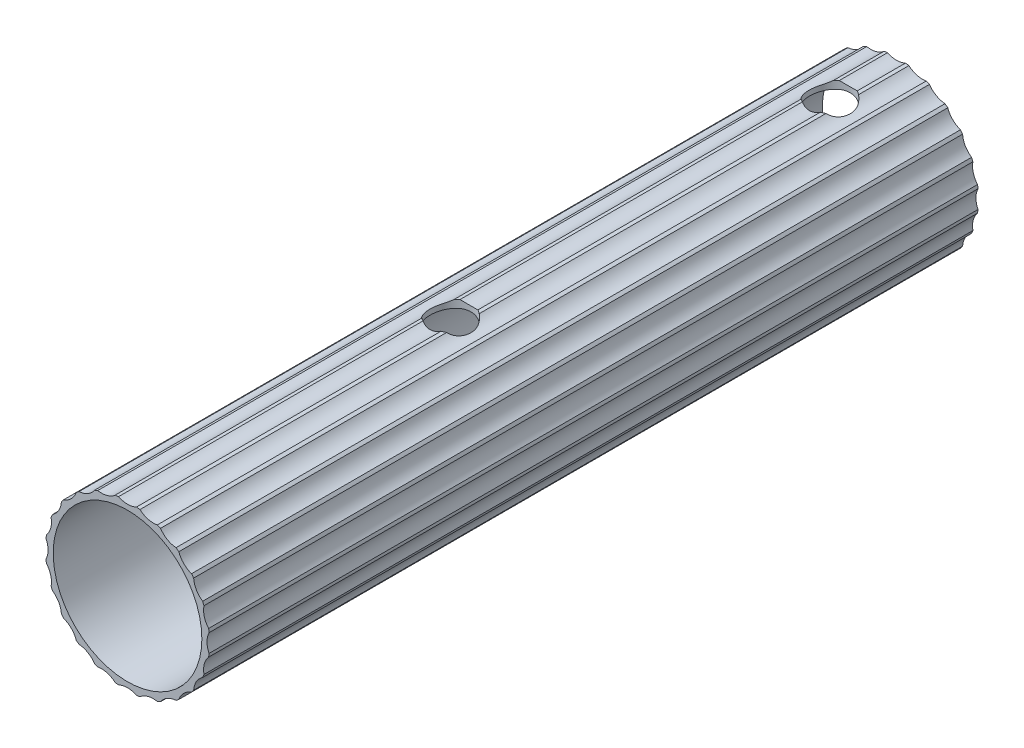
SolidWorks part; units mm, degrees
ref_plane "Plan de face" through (0, 0, 0) normal (0, 0, 1) x (1, 0, 0)
ref_plane "Plan de dessus" through (0, 0, 0) normal (0, 1, 0) x (1, 0, 0)
ref_plane "Plan de droite" through (0, 0, 0) normal (1, 0, 0) x (0, 0, -1)
sketch "Esquisse1" plane through (0, 0, 0) normal (0, 0, 1) x (1, 0, 0)
  circle A0 centre (0, 0) radius 14.5
  circle A1 centre (0, 0) radius 16
  dimension "D1" = 29
  dimension "D2" = 32
extrude "Boss.-Extru.1" add sketch "Esquisse1" along normal blind 150
sketch "Esquisse2" plane through (0, 0, 0) normal (0, 0, -1) x (-1, 0, 0)
  line L0 (0, 0) -> (-19.5, 0) construction
  circle A0 centre (-19.5, 0) radius 4
  dimension "D2" = 8
  dimension "D1" = 19.5
extrude "Enlèv. mat.-Extru.1" cut sketch "Esquisse2" against normal blind 150
pattern_circular "Répétition circulaire1" count 24 every 15 about axis through (0, 0, 0) along (0, 0, 1) of "Enlèv. mat.-Extru.1"
sketch "Esquisse4" plane through (0, 0, 0) normal (0, 1, 0) x (1, 0, 0)
  circle A0 centre (0, -13) radius 4
  circle A1 centre (0, -87) radius 4
  dimension "D1" = 8
  dimension "D2" = 13
  dimension "D3" = 87
extrude "Enlèv. mat.-Extru.2" cut sketch "Esquisse4" against normal mid plane 35
